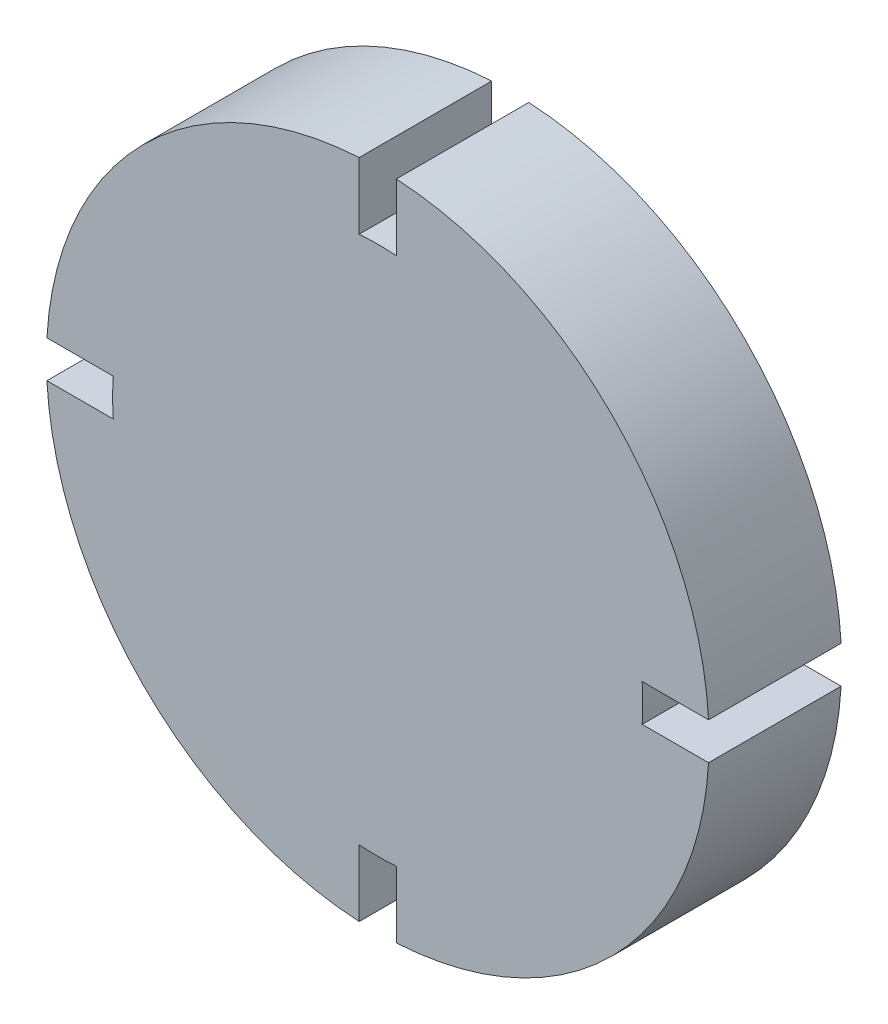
SolidWorks part; units mm, degrees
ref_plane "Front Plane" through (0, 0, 0) normal (0, 0, 1) x (1, 0, 0)
ref_plane "Top Plane" through (0, 0, 0) normal (0, 1, 0) x (1, 0, 0)
ref_plane "Right Plane" through (0, 0, 0) normal (1, 0, 0) x (0, 0, -1)
sketch "Sketch1" plane through (0, 0, 0) normal (0, 0, 1) x (1, 0, 0)
  line L0 (0, 28.8689) -> (0, -28.1078) construction
  line L1 (-35.3866, 0) -> (30.0784, 0) construction
  line L2 (-1.4, 24.9608) -> (-1.4, 19.9509)
  line L3 (1.4, 24.9608) -> (1.4, 19.9509)
  line L4 (24.9608, 1.4) -> (19.9509, 1.4)
  line L5 (24.9608, -1.4) -> (19.9509, -1.4)
  line L6 (1.4, -24.9608) -> (1.4, -19.9509)
  line L7 (-1.4, -24.9608) -> (-1.4, -19.9509)
  line L8 (-24.9608, -1.4) -> (-19.9509, -1.4)
  line L9 (-24.9608, 1.4) -> (-19.9509, 1.4)
  arc A0 (-24.9608, -1.4) -> (-1.4, -24.9608) centre (0, 0) ccw
  arc A1 (1.4, 19.9509) -> (-1.4, 19.9509) centre (0, 0) ccw
  arc A2 (1.4, -24.9608) -> (24.9608, -1.4) centre (0, 0) ccw
  arc A3 (24.9608, 1.4) -> (1.4, 24.9608) centre (0, 0) ccw
  arc A4 (-1.4, 24.9608) -> (-24.9608, 1.4) centre (0, 0) ccw
  arc A5 (-19.9509, 1.4) -> (-19.9509, -1.4) centre (0, 0) ccw
  arc A6 (-1.4, -19.9509) -> (1.4, -19.9509) centre (0, 0) ccw
  arc A7 (19.9509, -1.4) -> (19.9509, 1.4) centre (0, 0) ccw
  point P27 (0, 0)
extrude "Boss-Extrude1" add sketch "Sketch1" along normal blind 10
equation "\"D1@Sketch1\"= 10 + \"A\""
equation "\"A\" = 40"
equation "\"A@Sketch1\"=\"A\""
equation "\"D3@Sketch1\"=56/\"A\""
